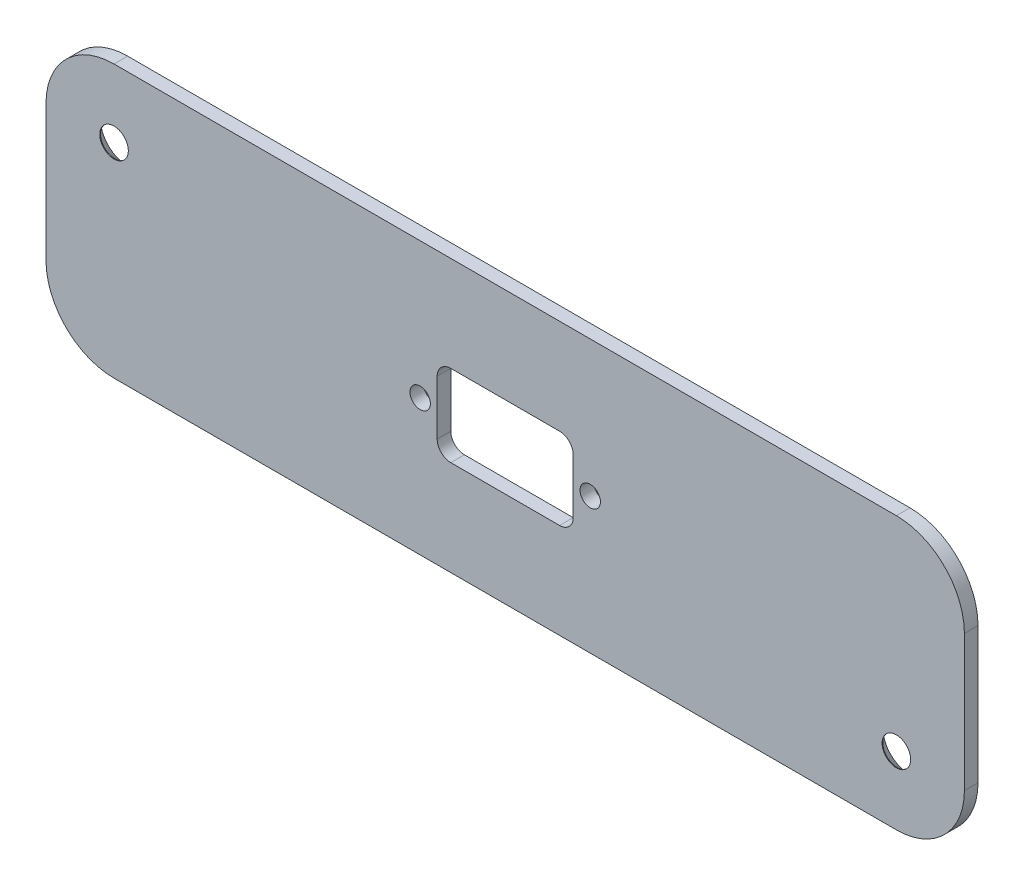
SolidWorks part; units mm, degrees
ref_plane "Plan de face" through (0, 0, 0) normal (0, 0, 1) x (1, 0, 0)
ref_plane "Plan de dessus" through (0, 0, 0) normal (0, 1, 0) x (1, 0, 0)
ref_plane "Plan de droite" through (0, 0, 0) normal (1, 0, 0) x (0, 0, -1)
sketch "Esquisse1" plane through (0, 0, 0) normal (0, 0, 1) x (1, 0, 0)
  line L1 (0, 0) -> (135, 0)
  line L2 (0, 0) -> (0, 40)
  line L3 (0, 40) -> (135, 40)
  line L4 (135, 0) -> (135, 40)
  dimension "D1" = 135
  dimension "D2" = 40
extrude "Boss.-Extru.1" add sketch "Esquisse1" along normal blind 2
sketch "Esquisse2" plane through (0, 0, 2) normal (0, 0, 1) x (1, 0, 0)
  line L0 (135, 40) -> (0, 40) construction
  line L1 (0, 40) -> (0, 0) construction
  line L2 (135, 0) -> (135, 40) construction
  line L3 (0, 0) -> (135, 0) construction
  circle A0 centre (10, 30) radius 2.1
  circle A2 centre (125, 10) radius 2.1
  dimension "D1" = 4.2
  dimension "D3" = 4.2
  dimension "D7" = 10
  dimension "D5" = 10
  dimension "D6" = 10
  dimension "D8" = 10
extrude "Enlèv. mat.-Extru.1" cut sketch "Esquisse2" against normal blind 2
chamfer "Chanfrein1" distance 1.9 angle 45 2 edges at (12.1, 30, 0) (127.1, 10, 0)
sketch "Esquisse3" plane through (0, 0, 0) normal (0, 0, -1) x (-1, 0, 0)
  line L0 (-135, 40) -> (0, 40) construction
  line L1 (-77.5, 26) -> (-57.5, 26)
  line L2 (-77.5, 26) -> (-77.5, 14)
  line L3 (-77.5, 14) -> (-57.5, 14)
  line L4 (-57.5, 26) -> (-57.5, 14)
  line L6 (-135, 0) -> (-135, 40) construction
  circle A0 centre (-80, 20) radius 1.5
  circle A1 centre (-55, 20) radius 1.5
  dimension "D1" = 3
  dimension "D2" = 3
  dimension "D3" = 20
  dimension "D4" = 25
  dimension "D5" = 2.5
  dimension "D6" = 12
  dimension "D7" = 6
  dimension "D8" = 14
  dimension "D9" = 57.5
  dimension "D11" = 6
extrude "Enlèv. mat.-Extru.2" cut sketch "Esquisse3" against normal through all
fillet "Congé2" radius 2 4 edges at (57.5, 14, 1) (57.5, 26, 1) (77.5, 26, 1) (77.5, 14, 1)
fillet "Congé3" radius 10 4 edges at (135, 0, 1) (0, 0, 1) (0, 40, 1) (135, 40, 1)
sketch "Esquisse4" plane through (0, 0, 0) normal (0, 0, -1) x (-1, 0, 0)
  text T0 "27 VC"
extrude "Enlèv. mat.-Extru.3" cut sketch "Esquisse4" against normal blind 1
